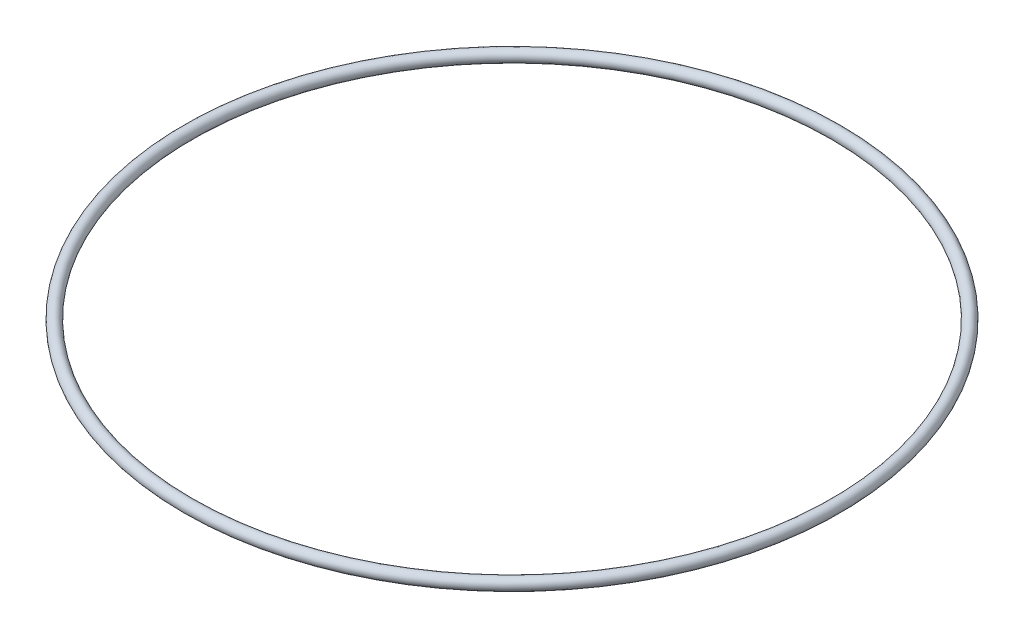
SolidWorks part; units mm, degrees
ref_plane "Plan1" through (0, 0, 0) normal (0, 0, 1) x (1, 0, 0)
ref_plane "Plan2" through (0, 0, 0) normal (0, 1, 0) x (1, 0, 0)
ref_plane "Plan3" through (0, 0, 0) normal (1, 0, 0) x (0, 0, -1)
sketch "Esquisse1" plane through (0, 0, 0) normal (0, 0, 1) x (1, 0, 0)
  line L1 (0, 0) -> (135, 0) construction
  line L2 (0, 1.25) -> (0, -1.25) construction
  circle A0 centre (68.75, 0) radius 1.25
  dimension "D2" = 68.75
  dimension "D1" = 2.5
  dimension "Diamètre du tore" = 2.5
  dimension "Diamètre intérieur" = 135
revolve "Base-Révolution" add sketch "Esquisse1" angle 360 about L2
equation " \"D1@Esquisse1\"=\"Diamètre du tore@Esquisse1\" "
equation "\"D2@Esquisse1\" = (\"Diamètre intérieur@Esquisse1\"/2)+(\"Diamètre du tore@Esquisse1\"/2)"
